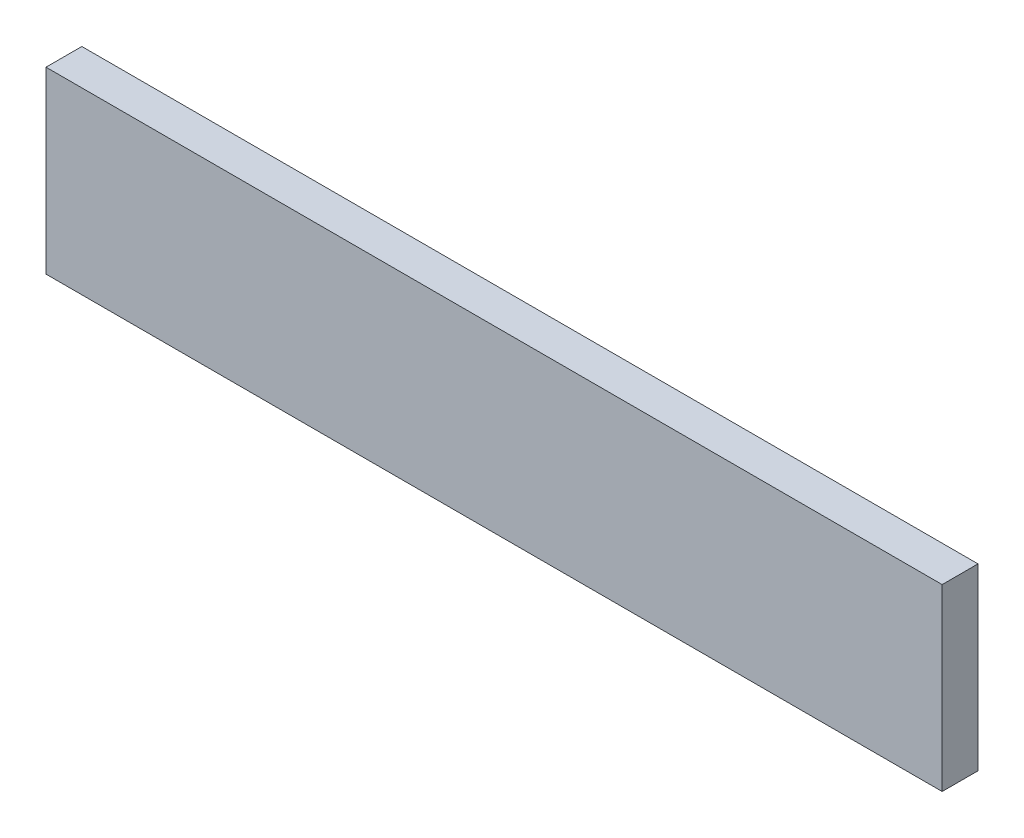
SolidWorks part; units mm, degrees
ref_plane "Front Plane" through (0, 0, 0) normal (0, 0, 1) x (1, 0, 0)
ref_plane "Top Plane" through (0, 0, 0) normal (0, 1, 0) x (1, 0, 0)
ref_plane "Right Plane" through (0, 0, 0) normal (1, 0, 0) x (0, 0, -1)
sketch "Sketch1" plane through (0, 0, 0) normal (0, 0, 1) x (1, 0, 0)
  line L1 (0, 0) -> (250, 0)
  line L2 (0, 0) -> (0, 50)
  line L3 (0, 50) -> (250, 50)
  line L4 (250, 0) -> (250, 50)
  dimension "D1" = 250
  dimension "D2" = 50
extrude "Boss-Extrude1" add sketch "Sketch1" along normal blind 10
